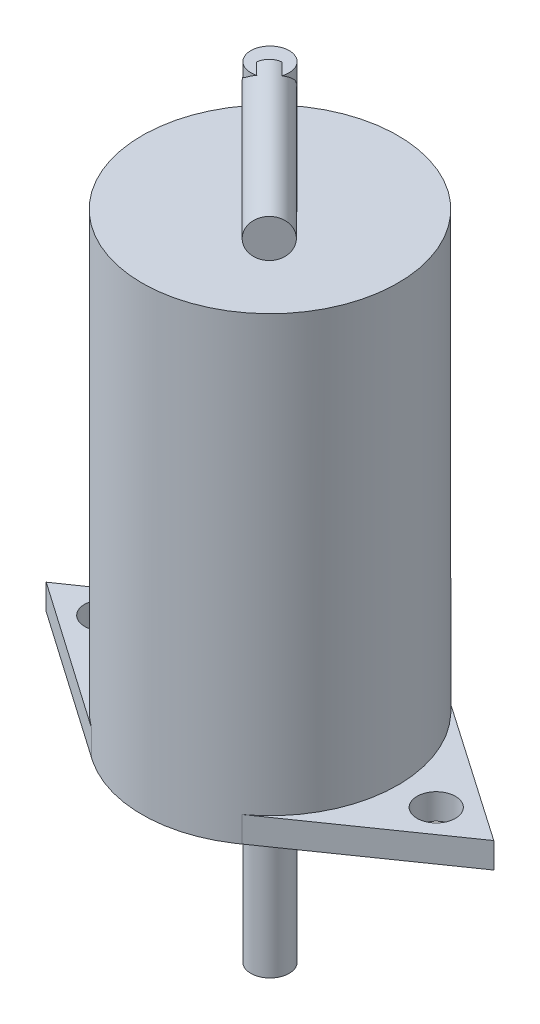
SolidWorks part; units mm, degrees
ref_plane "前视基准面" through (0, 0, 0) normal (0, 0, 1) x (1, 0, 0)
ref_plane "上视基准面" through (0, 0, 0) normal (0, 1, 0) x (1, 0, 0)
ref_plane "右视基准面" through (0, 0, 0) normal (1, 0, 0) x (0, 0, -1)
other "Configuration Table"
sketch "草图1" plane through (0, 0, 0) normal (0, 1, 0) x (1, 0, 0)
  circle A0 centre (0, 0) radius 10
extrude "凸台-拉伸1" add sketch "草图1" along normal blind 36
sketch "草图2" plane through (0, 0, 0) normal (0, -1, 0) x (1, 0, 0)
  line L2 (-14.5, 0) -> (-6.7679, 7.3618)
  line L3 (-14.5, 0) -> (-6.7679, -7.3618)
  line L4 (-6.7679, -7.3618) -> (6.7679, -7.3618)
  line L5 (6.7679, -7.3618) -> (14.5, 0)
  line L6 (-6.7679, 7.3618) -> (6.7679, 7.3618)
  line L7 (6.7679, 7.3618) -> (14.5, 0)
  circle A1 centre (0, 0) radius 10 construction
extrude "凸台-拉伸2" add sketch "草图2" against normal blind 2
sketch "草图5" plane through (0, 0, 0) normal (0, -1, 0) x (1, 0, 0)
  line L2 (-17.5, 0) -> (-5.5327, 8.33)
  line L3 (-5.5327, 8.33) -> (5.5327, 8.33)
  line L4 (5.5327, 8.33) -> (17.5, 0)
  line L5 (17.5, 0) -> (4.8917, -8.7219)
  line L6 (4.8917, -8.7219) -> (-4.8917, -8.7219)
  line L7 (-4.8917, -8.7219) -> (-17.5, 0)
  arc A0 (6.7679, 7.3618) -> (-6.7679, 7.3618) centre (0, 0) ccw construction
  arc A1 (-6.7679, -7.3618) -> (6.7679, -7.3618) centre (0, 0) ccw construction
extrude "凸台-拉伸3" add sketch "草图5" against normal blind 2
sketch "草图6" plane through (0, 0, 0) normal (0, -1, 0) x (1, 0, 0)
  line L0 (0, 0) -> (-13, 0)
  line L1 (0, 0) -> (13, 0)
  circle A0 centre (-13, 0) radius 1.5
  circle A1 centre (13, 0) radius 1.5
  dimension "D1" = 13
  dimension "D2" = 13
extrude "切除-拉伸1" cut sketch "草图6" against normal blind 2 contours A0 | A1
sketch "草图7" plane through (0, 0, 0) normal (0, -1, 0) x (1, 0, 0)
  circle A0 centre (0, 0) radius 1.5
extrude "凸台-拉伸4" add sketch "草图7" along normal blind 15
sketch "草图8" plane through (0, 36, 0) normal (0, 1, 0) x (1, 0, 0)
  line L1 (0, 0) -> (-7.0711, 7.0711)
  arc A0 (-6.4361, 7.6535) -> (-5.8904, -8.081) centre (0, 0) ccw construction
sketch3d "3D草图1"
  line L0 (-7.0711, 36, -7.0711) -> (-7.2594, 0, -7.084)
  line L1 (0, 36, 0) -> (-7.0711, 36, -7.0711) construction
  line L2 (-17.5, 0, 0) -> (-6.4361, 0, -7.6535) construction
sketch "草图9" plane through (0, 36, 0) normal (0, 1, 0) x (1, 0, 0)
  line L0 (0, 0) -> (7.0711, 7.0711)
  circle A0 centre (0, 0) radius 10 construction
sketch3d "3D草图2"
  line L0 (7.0711, 36, -7.0711) -> (7.0996, 0, -7.1945)
  line L1 (6.4361, 0, -7.6535) -> (17.5, 0, 0) construction
ref_plane "基准面1" through (-0.0475, 0.0001, -0.0475) normal (-0.7071, 0.0019, -0.7071) x (-0.7071, 0.0019, 0.7071)
sketch "草图10" plane through (-0.0475, 0.0001, -0.0475) normal (-0.7071, 0.0019, -0.7071) x (-0.7071, 0.0019, 0.7071)
  line L1 (0.0671, 35.9812) -> (0.124, -0.0191) construction
  circle A0 centre (0.1082, 9.9809) radius 1.5
extrude "凸台-拉伸5" add sketch "草图10" along normal blind 15
sketch "草图11" plane through (0, 36, 0) normal (0, 1, 0) x (1, 0, 0)
  circle A0 centre (0, 0) radius 1.5
extrude "凸台-拉伸6" add sketch "草图11" along normal blind 10
ref_plane "基准面2" through (-7.2594, 0, -7.084) normal (-0.0052, -1, -0.0004) x (-1, 0.0052, 0)
sketch "草图13" plane through (-0.0475, 0.0001, -0.0475) normal (-0.7071, 0.0019, -0.7071) x (-0.7071, 0.0019, 0.7071)
  circle A0 centre (0.1082, 9.9809) radius 1.5
extrude "凸台-拉伸7" add sketch "草图13" along normal blind 23
sketch "草图14" plane through (-0.0475, 0.0001, -0.0475) normal (-0.7071, 0.0019, -0.7071) x (-0.7071, 0.0019, 0.7071)
  circle A0 centre (0.1246, 44.671) radius 1.5
extrude "凸台-拉伸8" add sketch "草图14" against normal blind 15
